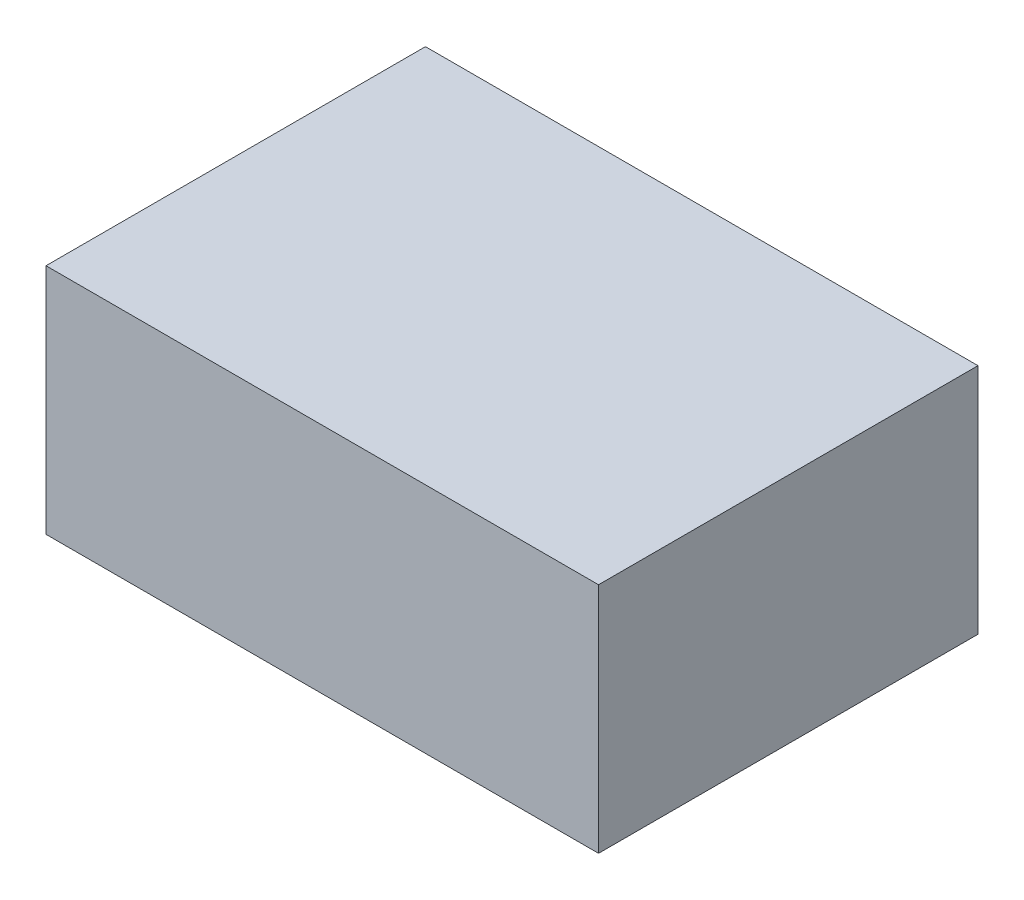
SolidWorks part; units mm, degrees
ref_plane "Front Plane" through (0, 0, 0) normal (0, 0, 1) x (1, 0, 0)
ref_plane "Top Plane" through (0, 0, 0) normal (0, 1, 0) x (1, 0, 0)
ref_plane "Right Plane" through (0, 0, 0) normal (1, 0, 0) x (0, 0, -1)
sketch "Sketch1" plane through (0, 0, 0) normal (0, 1, 0) x (1, 0, 0)
  line L1 (0, 0) -> (92.6316, 0)
  line L2 (0, 0) -> (0, -63.6166)
  line L3 (0, -63.6166) -> (92.6316, -63.6166)
  line L4 (92.6316, 0) -> (92.6316, -63.6166)
extrude "Extrude1" add sketch "Sketch1" along normal blind 39
sketch "Sketch2" plane through (0, 39, 0) normal (0, 1, 0) x (-1, 0, 0)
  line L0 (-92.6316, 31.8083) -> (-46.3158, 31.8083)
  line L2 (-92.6316, 63.6166) -> (-92.6316, 0) construction
  line L4 (-46.3158, 63.6166) -> (-46.3158, 31.8083)
  line L5 (0, 63.6166) -> (-92.6316, 63.6166) construction
